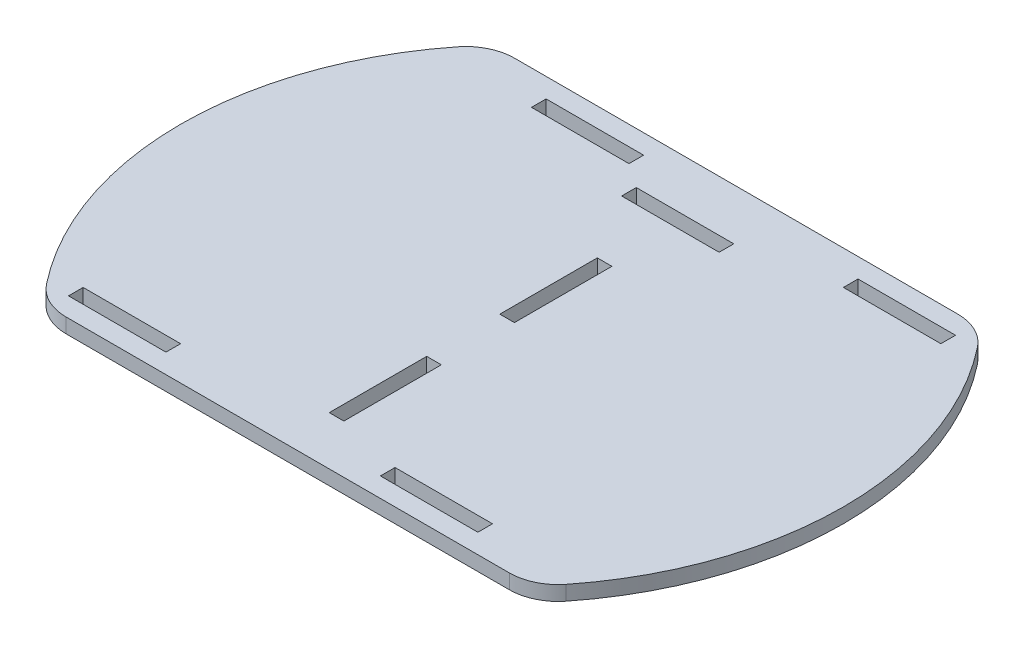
SolidWorks part; units mm, degrees
ref_plane "Front Plane" through (0, 0, 0) normal (0, 0, 1) x (1, 0, 0)
ref_plane "Top Plane" through (0, 0, 0) normal (0, 1, 0) x (1, 0, 0)
ref_plane "Right Plane" through (0, 0, 0) normal (1, 0, 0) x (0, 0, -1)
sketch "Sketch1" plane through (0, 0, 0) normal (0, 1, 0) x (1, 0, 0)
  line L0 (-52.0481, 54) -> (52.0481, 54)
  line L1 (-52.0481, -54) -> (52.0481, -54)
  line L2 (-55, 0) -> (55, 0) construction
  arc A0 (-52.0481, 54) -> (-74.1889, 11) centre (0, 0) ccw
  arc A1 (52.0481, -54) -> (74.1889, -11) centre (0, 0) ccw
  arc A2 (74.1889, 11) -> (52.0481, 54) centre (0, 0) ccw
  arc A3 (-74.1889, -11) -> (-52.0481, -54) centre (0, 0) ccw
  arc A4 (-74.1889, 11) -> (-74.1889, -11) centre (0, 0) ccw
  arc A5 (74.1889, 11) -> (74.1889, -11) centre (0, 0) cw
  point P5 (0, 54)
  dimension "D1" = 150
  dimension "D2" = 54
  dimension "D3" = 54
extrude "Boss-Extrude1" add sketch "Sketch1" along normal blind 3
sketch "Sketch2" plane through (0, 3, 0) normal (0, 1, 0) x (1, 0, 0)
  line L0 (-52.0481, -54) -> (52.0481, -54) construction
  line L1 (-49, -39) -> (-29, -39)
  line L2 (-49, -39) -> (-49, -42)
  line L3 (-49, -42) -> (-29, -42)
  line L4 (-29, -39) -> (-29, -42)
  line L5 (15, -39) -> (35, -39)
  line L6 (15, -39) -> (15, -42)
  line L7 (15, -42) -> (35, -42)
  line L8 (35, -39) -> (35, -42)
  line L9 (29, 42) -> (49, 42)
  line L10 (29, 42) -> (29, 39)
  line L11 (29, 39) -> (49, 39)
  line L12 (49, 42) -> (49, 39)
  line L13 (-35, 42) -> (-15, 42)
  line L14 (-35, 42) -> (-35, 39)
  line L15 (-35, 39) -> (-15, 39)
  line L16 (-15, 42) -> (-15, 39)
  line L17 (52.0481, 54) -> (-52.0481, 54) construction
  line L18 (0, -1.65) -> (0, 1.65) construction
  dimension "D1" = 20
  dimension "D2" = 20
  dimension "D3" = 20
  dimension "D4" = 20
  dimension "D5" = 3
  dimension "D6" = 3
  dimension "D7" = 3
  dimension "D8" = 3
  dimension "D9" = 12
  dimension "D10" = 12
  dimension "D11" = 12
  dimension "D12" = 12
  dimension "D13" = 29
  dimension "D14" = 29
  dimension "D15" = 15
  dimension "D16" = 15
extrude "Cut-Extrude1" cut sketch "Sketch2" against normal blind 10
sketch "Sketch3" plane through (0, 3, 0) normal (0, 1, 0) x (1, 0, 0)
  line L0 (0, -1.65) -> (0, 1.65) construction
  line L1 (1.5, -1) -> (-1.5, -1)
  line L2 (1.5, -1) -> (1.5, 19)
  line L3 (1.5, 19) -> (-1.5, 19)
  line L4 (-1.5, -1) -> (-1.5, 19)
  line L5 (1.5, -1) -> (-1.5, 19) construction
  line L6 (1.5, 19) -> (-1.5, -1) construction
  line L7 (-52.0481, -54) -> (52.0481, -54) construction
  line L8 (-1.5, -36) -> (1.5, -36)
  line L9 (-1.5, -36) -> (-1.5, -16)
  line L10 (-1.5, -16) -> (1.5, -16)
  line L11 (1.5, -36) -> (1.5, -16)
  line L12 (-1.5, -36) -> (1.5, -16) construction
  line L13 (-1.5, -16) -> (1.5, -36) construction
  point P0 (0, 9)
  point P7 (0, -26)
  dimension "D1" = 20
  dimension "D2" = 20
  dimension "D3" = 3
  dimension "D4" = 3
  dimension "D5" = 15
  dimension "D6" = 18
extrude "Cut-Extrude2" cut sketch "Sketch3" against normal blind 10
sketch "Sketch4" plane through (0, 3, 0) normal (0, 1, 0) x (1, 0, 0)
  line L0 (-52.0481, -54) -> (52.0481, -54) construction
  line L1 (-62.1983, -46) -> (64.85, -46)
  line L2 (-62.1983, -46) -> (-62.1983, -62.9116)
  line L3 (-62.1983, -62.9116) -> (64.85, -62.9116)
  line L4 (64.85, -46) -> (64.85, -62.9116)
  line L5 (-1.65, 0) -> (1.65, 0) construction
  line L6 (64.85, 46) -> (64.85, 62.9116)
  line L7 (-62.1983, 62.9116) -> (64.85, 62.9116)
  line L8 (-62.1983, 46) -> (-62.1983, 62.9116)
  line L9 (-62.1983, 46) -> (64.85, 46)
  dimension "D1" = 8
extrude "Cut-Extrude3" cut sketch "Sketch4" against normal blind 3
sketch "Sketch5" plane through (0, 3, 0) normal (0, 1, 0) x (1, 0, 0)
  line L0 (-59.2368, 46) -> (59.2368, 46) construction
  line L1 (59.2368, -46) -> (-59.2368, -46) construction
  line L2 (-50.0799, 46) -> (-86.9107, 46)
  line L3 (-86.9107, 46) -> (-86.9107, -46)
  line L4 (-86.9107, -46) -> (-50.0799, -46)
  line L5 (50.0799, 46) -> (92.4203, 46)
  line L6 (92.4203, 46) -> (92.4203, -46)
  line L7 (92.4203, -46) -> (50.0799, -46)
  arc A0 (50.0799, 46) -> (50.0799, -46) centre (0, 0) cw
  arc A1 (-50.0799, 46) -> (-50.0799, -46) centre (0, 0) ccw
  dimension "D1" = 68
  dimension "D2" = 68
extrude "Cut-Extrude4" cut sketch "Sketch5" against normal blind 3
sketch "Sketch6" plane through (0, 3, 0) normal (0, 1, 0) x (1, 0, 0)
  line L0 (0, -1.65) -> (0, 1.65) construction
  line L1 (-10, 35.5) -> (10, 35.5)
  line L2 (-10, 35.5) -> (-10, 32.5)
  line L3 (-10, 32.5) -> (10, 32.5)
  line L4 (10, 35.5) -> (10, 32.5)
  line L5 (-50.0799, 46) -> (50.0799, 46) construction
  dimension "D1" = 20
  dimension "D2" = 3
  dimension "D3" = 10
  dimension "D4" = 10.5
extrude "Cut-Extrude5" cut sketch "Sketch6" against normal blind 3
fillet "Fillet1" radius 10 4 edges at (50.0799, 1.5, 46) (50.0799, 1.5, -46) (-50.0799, 1.5, -46) (-50.0799, 1.5, 46)
